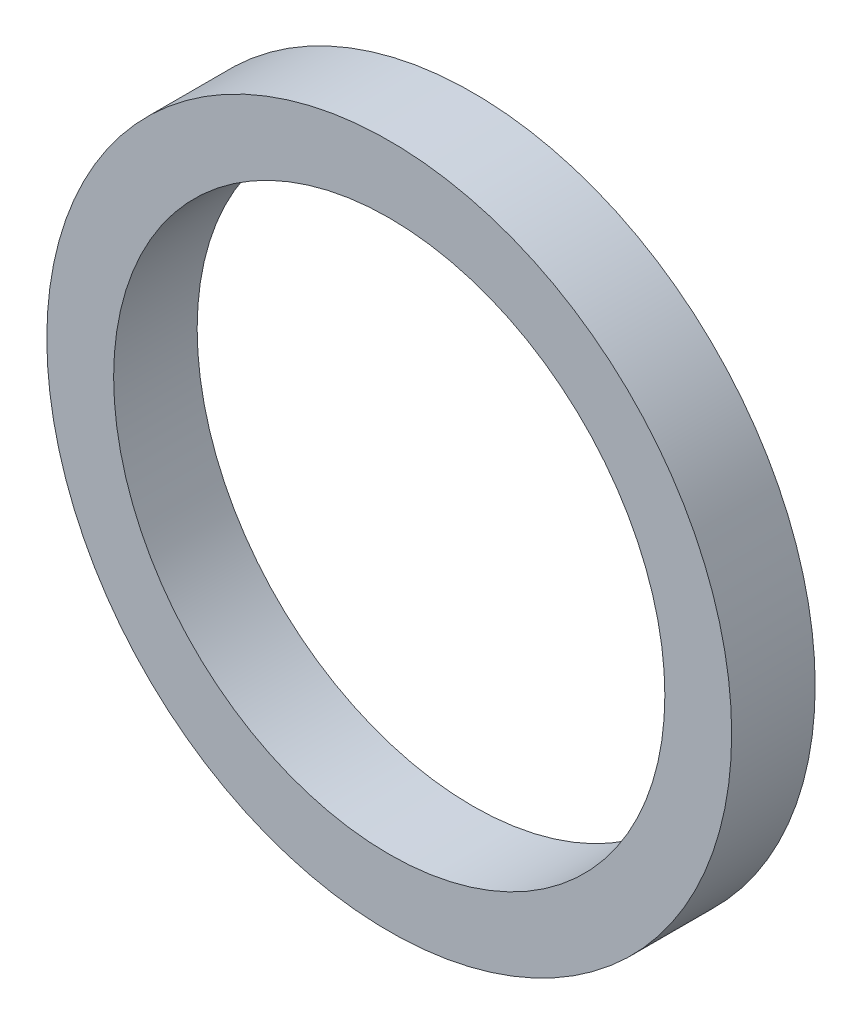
SolidWorks part; units mm, degrees
ref_plane "前基準面" through (0, 0, 0) normal (0, 0, 1) x (1, 0, 0)
ref_plane "上基準面" through (0, 0, 0) normal (0, 1, 0) x (1, 0, 0)
ref_plane "右基準面" through (0, 0, 0) normal (1, 0, 0) x (0, 0, -1)
sketch "草圖1" plane through (0, 0, 0) normal (0, 0, 1) x (1, 0, 0)
  circle A0 centre (0, 0) radius 8.25
  circle A1 centre (0, 0) radius 10.25
  dimension "D2" = 16.5
  dimension "D1" = 2
extrude "填料-伸長1" add sketch "草圖1" along normal blind 2.5
